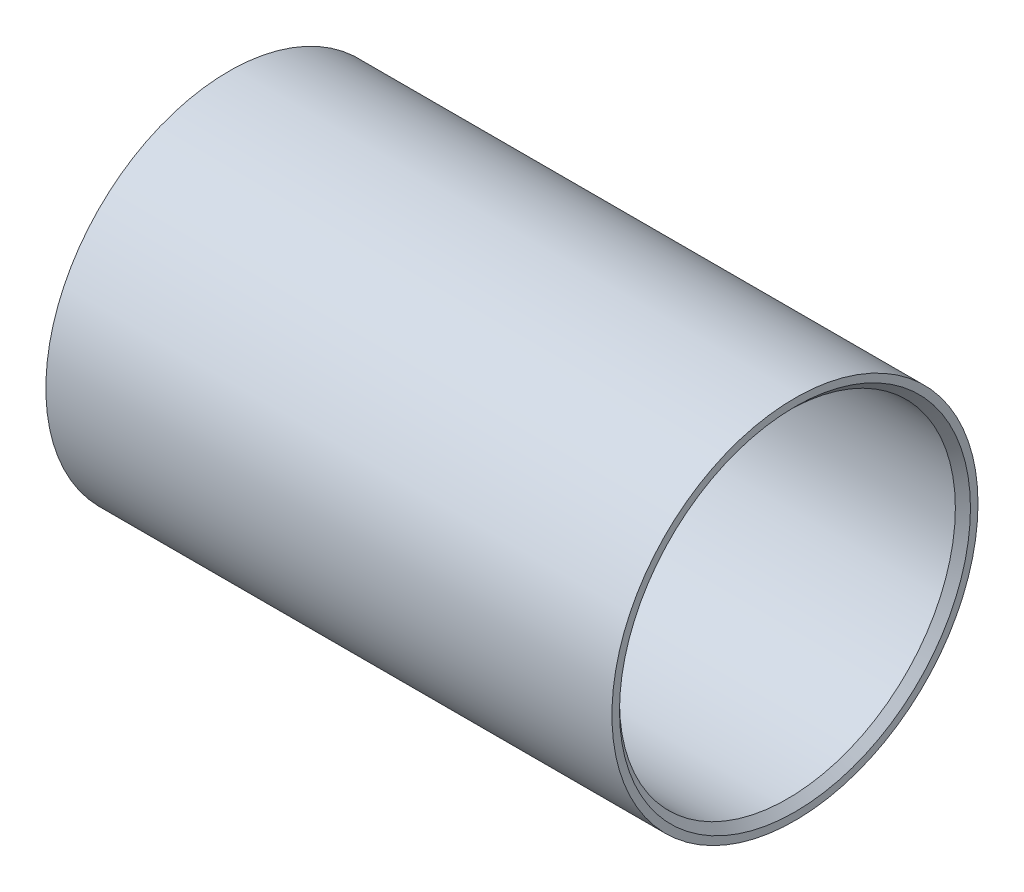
SolidWorks part; units mm, degrees
ref_plane "Front Plane" through (0, 0, 0) normal (0, 0, 1) x (1, 0, 0)
ref_plane "Top Plane" through (0, 0, 0) normal (0, 1, 0) x (1, 0, 0)
ref_plane "Right Plane" through (0, 0, 0) normal (1, 0, 0) x (0, 0, -1)
sketch "Sketch1" plane through (0, 0, 0) normal (1, 0, 0) x (0, 0, -1)
  circle A0 centre (0, 0) radius 44.5
  circle A1 centre (0, 0) radius 48.5
  dimension "D1" = 89
  dimension "D2" = 4
extrude "Extrude1" add sketch "Sketch1" along normal mid plane 150
chamfer "Chamfer1" distance 2 angle 45 2 edges at (-75, 0, -44.5) (75, 0, -44.5)
